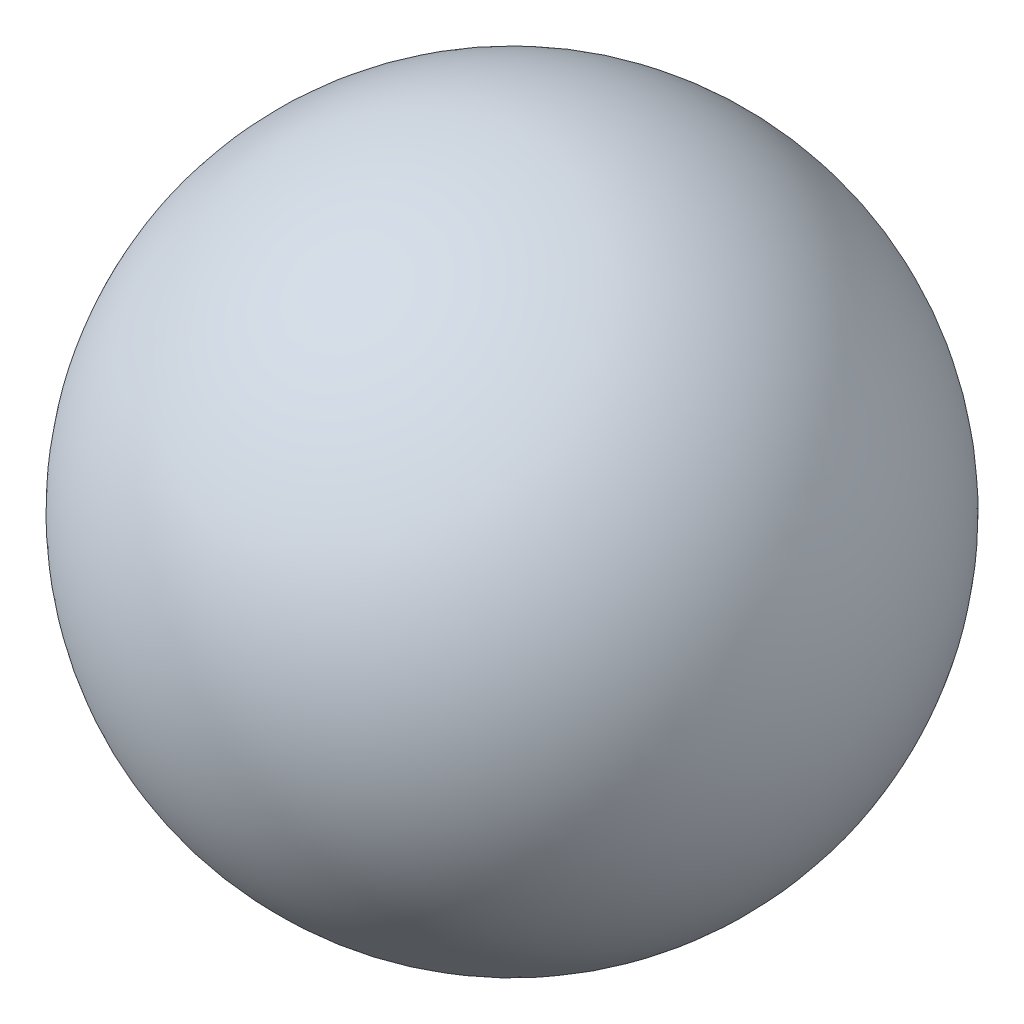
SolidWorks part; units mm, degrees
ref_plane "Plan1" through (0, 0, 0) normal (0, 0, 1) x (1, 0, 0)
ref_plane "Plan2" through (0, 0, 0) normal (0, 1, 0) x (1, 0, 0)
ref_plane "Plan3" through (0, 0, 0) normal (1, 0, 0) x (0, 0, -1)
sketch "Esquisse1" plane through (0, 0, 0) normal (0, 1, 0) x (1, 0, 0)
  line L1 (-0.6, 4.4) -> (9.4, 4.4) construction
  line L2 (-0.6, 8.8) -> (-0.6, 0) construction
  line L3 (9.4, 8.8) -> (9.4, 0) construction
  line L4 (1.9, 4.4) -> (6.9, 4.4)
  circle A1 centre (4.4, 4.4) radius 2.5 construction
  arc A2 (6.9, 4.4) -> (1.9, 4.4) centre (4.4, 4.4) ccw
revolve "Base-Révolution" add sketch "Esquisse1" angle 360 about L1
